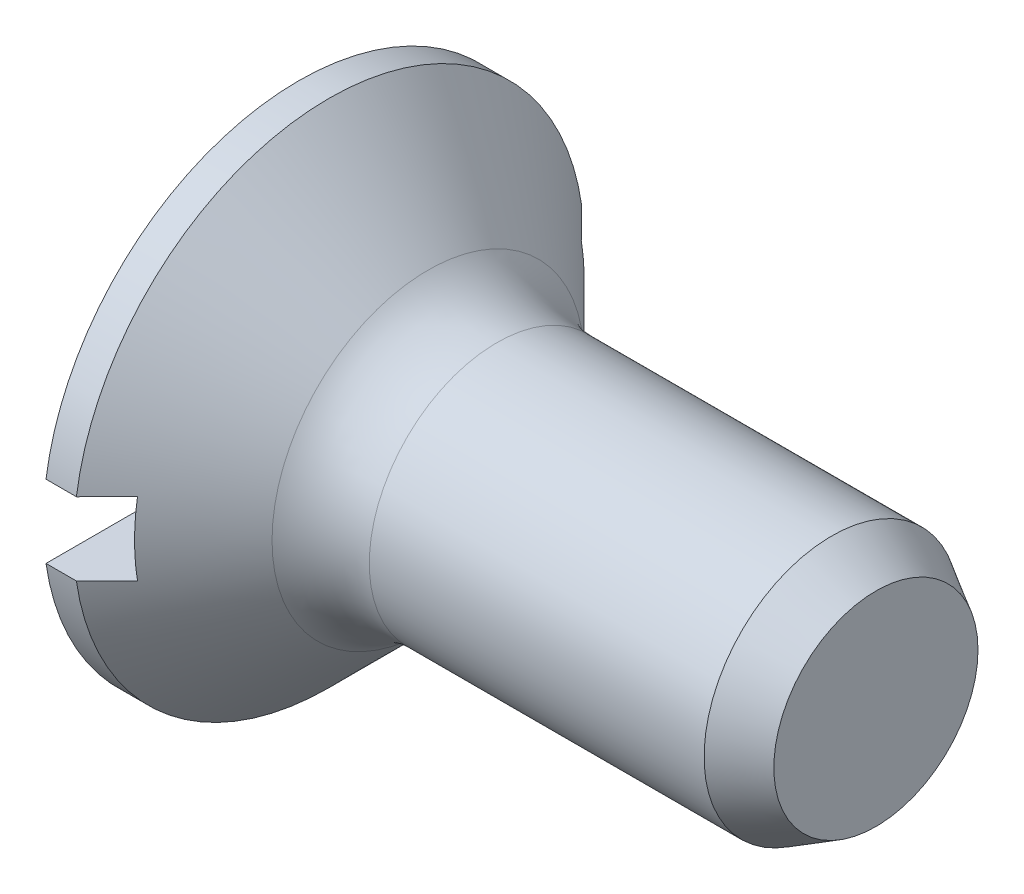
SolidWorks part; units mm, degrees
ref_plane "Front" through (0, 0, 0) normal (0, 0, 1) x (1, 0, 0)
ref_plane "Top" through (0, 0, 0) normal (0, 1, 0) x (1, 0, 0)
ref_plane "Right" through (0, 0, 0) normal (1, 0, 0) x (0, 0, -1)
sketch "Sketch1" plane through (0, 0, 0) normal (0, 0, 1) x (1, 0, 0)
  line L0 (0, 4.2) -> (0.5, 4.2)
  line L1 (0.5, 4.2) -> (2.6, 2.1)
  line L2 (2.6, 2.1) -> (9.5, 2.1)
  line L3 (9.5, 2.1) -> (9.5, 0)
  line L4 (9.5, 0) -> (0, 0)
  line L5 (0, 0) -> (0, 4.2)
  line L6 (6.6207, 0) -> (-0.9387, 0) construction
  dimension "D1" = 45
  dimension "d" = 4.2
  dimension "dK" = 8.4
  dimension "k" = 2.6
  dimension "l" = 9.5
revolve "Revolve1" add sketch "Sketch1" angle 360 about L6
sketch "Sketch2" plane through (0, 0, 0) normal (0, 0, 1) x (1, 0, 0)
  line L0 (0, 4.2) -> (0, -4.2) construction
  line L1 (0, 0.6) -> (1, 0.6)
  line L2 (0, 0.6) -> (0, -0.6)
  line L3 (0, -0.6) -> (1, -0.6)
  line L4 (1, 0.6) -> (1, -0.6)
  dimension "n" = 1.2
  dimension "t" = 1
extrude "Cut-Extrude1" cut sketch "Sketch2" against normal through all and the other way through all
chamfer "Chamfer1" distance 0.42 angle 60 1 edges at (9.5, 0, -2.1)
sketch "Sketch4" plane through (0, 0, 0) normal (0, 0, 1) x (1, 0, 0)
  line L0 (3.8225, 1.55) -> (3.0575, 1.55)
  line L1 (3.0575, 1.55) -> (2.74, 2.1)
  line L2 (3.8225, 1.55) -> (4.14, 2.1)
  line L3 (2.74, 2.1) -> (2.74, 2.35)
  line L4 (4.14, 2.1) -> (4.14, 2.35)
  line L5 (2.74, 2.35) -> (4.14, 2.35)
  line L6 (3.44, 1.55) -> (3.44, 0) construction
  line L7 (0, 0) -> (7.3035, 0) construction
  line L9 (8.7725, 2.1) -> (2.6, 2.1) construction
  line L12 (2.6, 2.1) -> (2.6, -2.1) construction
  dimension "D2" = 60
  dimension "D3" = 0.25
  dimension "threadstart" = 0.84
  dimension "minordia" = 3.1
  dimension "advance" = 1.4
revolve "ThreadSchematic" [suppressed] cut sketch "Sketch4" angle 360 about L7
pattern_linear "ThdSchPat" [suppressed] count 5 spacing 1.4 along (-1, 0, 0)
sketch "Sketch3" plane through (0, 0, 0) normal (0, 0, 1) x (1, 0, 0)
  line L0 (2.6, 2.1) -> (9.5, 2.1) construction
  line L2 (5.8, 2.1) -> (6.725, 2.1) construction
  line L3 (9.5, 2.1) -> (9.5, 0) construction
  line L4 (6.725, 2.1) -> (9.5, 0)
  line L5 (2.9, 0) -> (5.4301, 0) construction
  line L6 (9.5, 0) -> (9.7, 0)
  line L7 (9.7, 0) -> (9.7, 2.1)
  line L8 (9.7, 2.1) -> (9.5, 2.1)
  line L9 (6.725, 2.1) -> (9.5, 2.1)
  dimension "D1" = 0.925
  dimension "y" = 3.7
  dimension "D2" = 0.2
revolve "EndCone" [suppressed] cut sketch "Sketch3" angle 360 about L5
fillet "Fillet1" radius 1.6 1 edges at (2.6, 0, -2.1)
equation "\"minordia@sketch4\" = \"D2@ThreadCosmetic\""
equation "\"D1@Chamfer1\" = \"d@Sketch1\" / 10"
equation "\"D1@Sketch3\" = \"y@Sketch3\" / 4"
equation "\"threadstart@Sketch4\" = \"advance@Sketch4\"*0.6"
equation "\"D1@ThdSchPat\" = int(((\"l@Sketch1\"-\"k@Sketch1\")/\"advance@Sketch4\") + 0.999)"
equation "\"D3@ThdSchPat\" =\"advance@Sketch4\""
